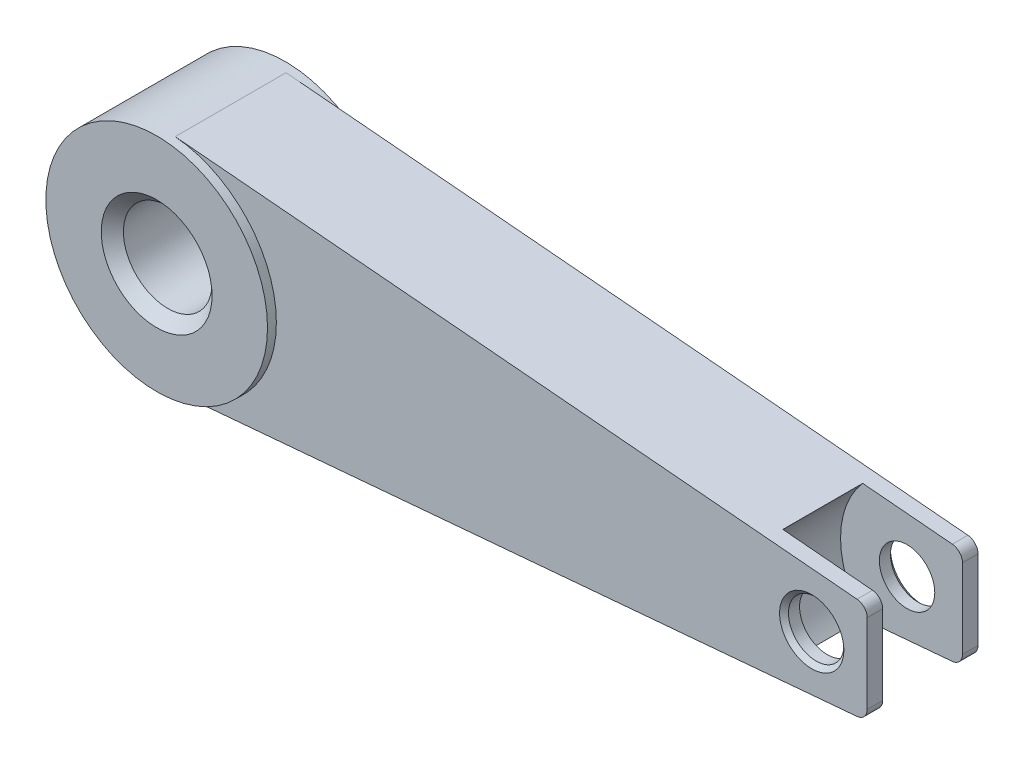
SolidWorks part; units mm, degrees
ref_plane "Ön Düzlem" through (0, 0, 0) normal (0, 0, 1) x (1, 0, 0)
ref_plane "Üst Düzlem" through (0, 0, 0) normal (0, 1, 0) x (1, 0, 0)
ref_plane "Sağ Düzlem" through (0, 0, 0) normal (1, 0, 0) x (0, 0, -1)
sketch "Çizim1" plane through (0, 0, 0) normal (0, 0, 1) x (1, 0, 0)
  circle A0 centre (0, 0) radius 5
  dimension "D1" = 10
extrude "Yükseklik-Ekstrüzyon1" add sketch "Çizim1" along normal blind 5.8
ref_plane "Düzlem1" through (0, 0, 2.9) normal (0, 0, 1) x (1, 0, 0)
sketch "Çizim2" plane through (0, 0, 2.9) normal (0, 0, 1) x (1, 0, 0)
  line L0 (0, 6.1775) -> (0, -7.3121) construction
  line L1 (-7.06, 0) -> (7.8374, 0) construction
  line L2 (0.4358, 4.981) -> (31.6509, 2.25)
  line L3 (31.6509, 2.25) -> (31.6509, -2.25)
  line L4 (31.6509, -2.25) -> (0.4358, -4.981)
  circle A0 centre (0, 0) radius 5 construction
  circle A2 centre (0, 0) radius 5
  arc A3 (0.4358, 4.981) -> (0.4358, -4.981) centre (0, 0) ccw
  dimension "D1" = 5
  dimension "D2" = 5
  dimension "D3" = 4.5
  dimension "D4" = 0
extrude "Yükseklik-Ekstrüzyon2" add sketch "Çizim2" along normal blind 2.5 and the other way blind 2.5
sketch "Çizim3" plane through (0, 0, 5.8) normal (0, 0, 1) x (1, 0, 0)
  circle A0 centre (0, 0) radius 2
  dimension "D1" = 4
extrude "Kes-Ekstrüzyon1" cut sketch "Çizim3" against normal blind 12.5
chamfer "Pah1" distance 0.5 angle 45 2 edges at (2, 0, 0) (2, 0, 5.8)
sketch "Çizim4" plane through (0, 0, 2.9) normal (0, 0, 1) x (1, 0, 0)
  line L0 (31.6509, -2.25) -> (31.6509, 2.25) construction
  circle A0 centre (30.1509, 0) radius 4
  dimension "D1" = 8
  dimension "D2" = 1.5
extrude "Kes-Ekstrüzyon2" cut sketch "Çizim4" against normal blind 1.8 and the other way blind 1.8
sketch "Çizim5" plane through (0, 0, 5.4) normal (0, 0, 1) x (1, 0, 0)
  line L0 (31.6509, -2.25) -> (31.6509, 2.25) construction
  circle A0 centre (29.1509, 0) radius 1.25
  dimension "D1" = 2.5
  dimension "D2" = 2.5
extrude "Kes-Ekstrüzyon3" cut sketch "Çizim5" against normal blind 6.8
chamfer "Pah2" distance 0.2 angle 45 2 edges at (30.4009, 0, 0.4) (30.4009, 0, 5.4)
fillet "Radyus1" radius 0.5 4 edges at (31.6509, -2.25, 5.05) (31.6509, 2.25, 5.05) (31.6509, -2.25, 0.75) (31.6509, 2.25, 0.75)
